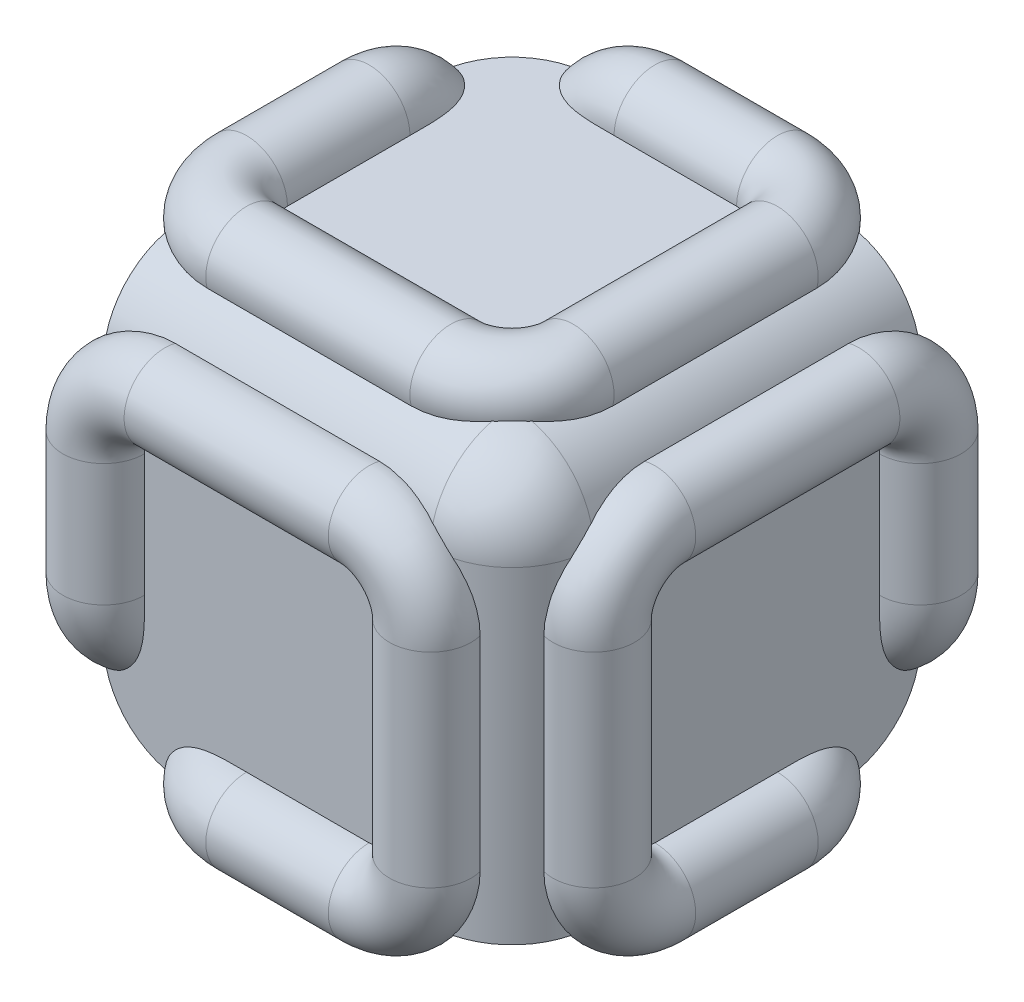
SolidWorks part; units mm, degrees
ref_plane "Front Plane" through (0, 0, 0) normal (0, 0, 1) x (1, 0, 0)
ref_plane "Top Plane" through (0, 0, 0) normal (0, 1, 0) x (1, 0, 0)
ref_plane "Right Plane" through (0, 0, 0) normal (1, 0, 0) x (0, 0, -1)
sketch "Sketch1" plane through (0, 0, 0) normal (0, 1, 0) x (1, 0, 0)
  line L1 (0, 0) -> (100, 0)
  line L2 (0, 0) -> (0, 100)
  line L3 (0, 100) -> (100, 100)
  line L4 (100, 0) -> (100, 100)
  dimension "D1" = 100
extrude "Boss-Extrude1" add sketch "Sketch1" along normal blind 100
fillet "Fillet1" radius 20 6 edges at (50, 0, -100) (0, 0, -50) (0, 50, -100) (100, 50, 0) (100, 100, -50) (50, 100, 0)
sketch3d "3DSketch2"
  line L0 (65, 100, -100) -> (35, 100, -100)
  line L2 (35, 20, -100) -> (85, 20, -100)
  line L3 (100, 80, -85) -> (100, 80, -35)
  line L4 (100, 65, -20) -> (100, 15, -20)
  line L5 (100, 0, -65) -> (100, 0, -35)
  line L6 (85, 0, -80) -> (35, 0, -80)
  line L7 (20, 0, -65) -> (20, 0, -15)
  line L8 (35, 0, 0) -> (65, 0, 0)
  line L9 (80, 15, 0) -> (80, 65, 0)
  line L10 (65, 80, 0) -> (15, 80, 0)
  line L11 (0, 65, 0) -> (0, 35, 0)
  line L12 (15, 100, -20) -> (65, 100, -20)
  line L13 (80, 100, -35) -> (80, 100, -85)
  line L14 (20, 85, -100) -> (20, 35, -100)
  line L15 (100, 35, -100) -> (100, 65, -100)
  line L16 (0, 20, -15) -> (0, 20, -65)
  line L17 (0, 35, -80) -> (0, 85, -80)
  line L18 (0, 100, -65) -> (0, 100, -35)
  arc A0 (0, 35, 0) -> (0, 20, -15) centre (0, 35, -15) ccw
  arc A1 (15, 80, 0) -> (0, 65, 0) centre (15, 65, 0) ccw
  arc A2 (80, 65, 0) -> (65, 80, 0) centre (65, 65, 0) ccw
  arc A3 (20, 0, -15) -> (35, 0, 0) centre (35, 0, -15) ccw
  arc A4 (65, 0, 0) -> (80, 15, 0) centre (65, 15, 0) ccw
  arc A5 (0, 20, -65) -> (0, 35, -80) centre (0, 35, -65) ccw
  arc A6 (0, 85, -80) -> (0, 100, -65) centre (0, 85, -65) ccw
  arc A7 (15, 100, -20) -> (0, 100, -35) centre (15, 100, -35) ccw
  arc A8 (65, 100, -20) -> (80, 100, -35) centre (65, 100, -35) ccw
  arc A9 (100, 80, -35) -> (100, 65, -20) centre (100, 65, -35) ccw
  arc A10 (100, 15, -20) -> (100, 0, -35) centre (100, 15, -35) ccw
  arc A11 (100, 0, -65) -> (85, 0, -80) centre (85, 0, -65) ccw
  arc A12 (100, 80, -85) -> (100, 65, -100) centre (100, 65, -85) ccw
  arc A13 (80, 100, -85) -> (65, 100, -100) centre (65, 100, -85) ccw
  arc A14 (35, 100, -100) -> (20, 85, -100) centre (35, 85, -100) ccw
  arc A15 (35, 20, -100) -> (20, 35, -100) centre (35, 35, -100) ccw
  arc A16 (85, 20, -100) -> (100, 35, -100) centre (85, 35, -100) ccw
  arc A17 (35, 0, -80) -> (20, 0, -65) centre (35, 0, -65) ccw
  point P36 (0, 20, 0)
  point P40 (15, 35, -15)
  point P43 (0, 80, 0)
  point P44 (15, 65, 15)
  point P47 (80, 80, 0)
  point P48 (65, 65, 15)
  point P51 (20, 0, 0)
  point P52 (35, 15, -15)
  point P55 (80, 0, 0)
  point P56 (65, 15, 15)
  point P59 (0, 20, -80)
  point P60 (15, 35, -65)
  point P63 (0, 100, -80)
  point P64 (15, 85, -65)
  point P67 (0, 100, -20)
  point P68 (15, 85, -35)
  point P71 (80, 100, -20)
  point P72 (65, 115, -35)
  point P75 (100, 80, -20)
  point P76 (115, 65, -35)
  point P79 (100, 0, -20)
  point P80 (115, 15, -35)
  point P83 (100, 0, -80)
  point P84 (85, 15, -65)
  point P87 (100, 80, -100)
  point P88 (85, 65, -85)
  point P91 (80, 100, -100)
  point P92 (65, 115, -85)
  point P95 (20, 100, -100)
  point P96 (35, 85, -85)
  point P99 (20, 20, -100)
  point P100 (35, 35, -115)
  point P103 (100, 20, -100)
  point P104 (85, 35, -85)
  point P107 (20, 0, -80)
  point P108 (35, 15, -65)
  dimension "D1" = 15
  dimension "D2" = 15
ref_plane "Plane1" through (20, 35, -100) normal (0, -1, 0) x (-1, 0, 0)
sketch "Sketch2" plane through (20, 35, -100) normal (0, -1, 0) x (-1, 0, 0)
  circle A0 centre (0, 0) radius 10
  point P2 (0, 0)
  dimension "D1" = 20
sweep "Sweep1" add profiles "Sketch2" path "3DSketch2"
